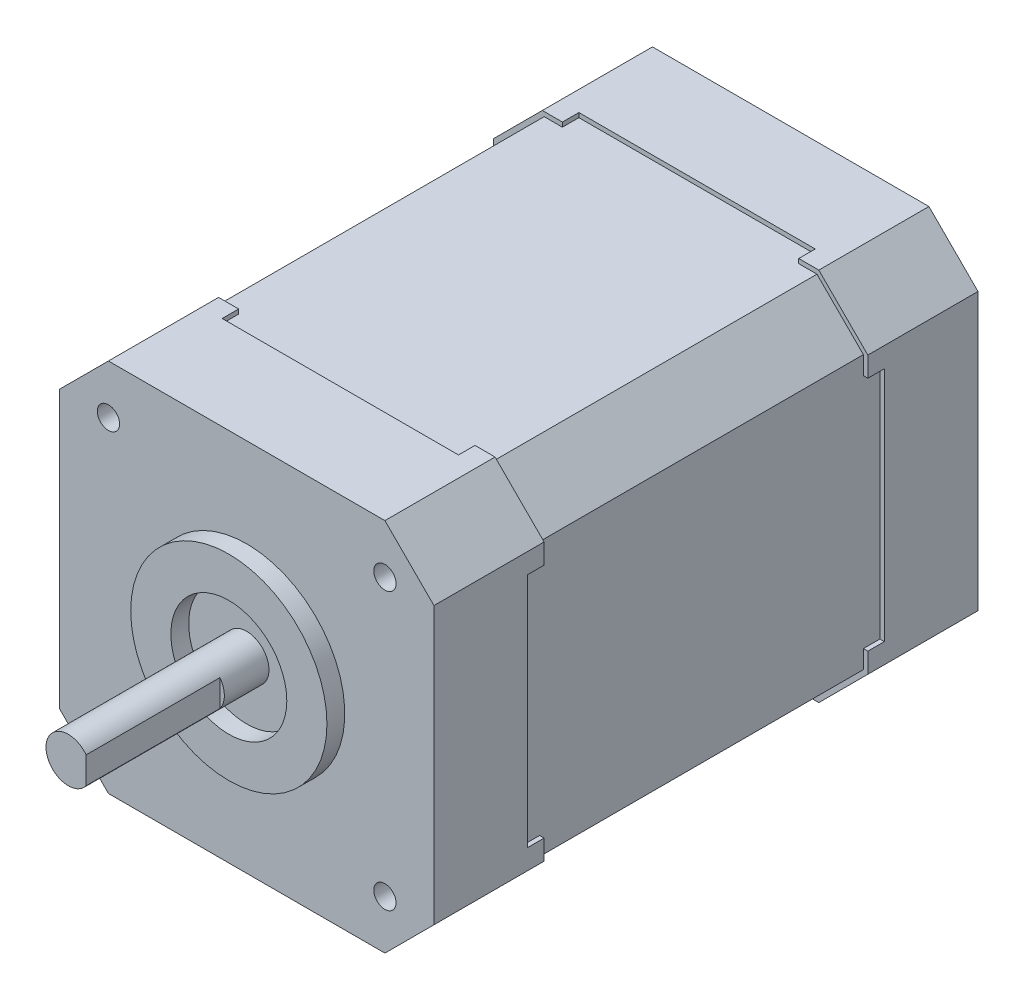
SolidWorks part; units mm, degrees
ref_plane "前基準面" through (0, 0, 0) normal (0, 0, 1) x (1, 0, 0)
ref_plane "上基準面" through (0, 0, 0) normal (0, 1, 0) x (1, 0, 0)
ref_plane "右基準面" through (0, 0, 0) normal (1, 0, 0) x (0, 0, -1)
sketch "草圖1" plane through (0, 0, 0) normal (0, 0, 1) x (1, 0, 0)
  line L0 (-21, 15.5) -> (-15.5, 21)
  line L1 (-15.5, 21) -> (15.5, 21)
  line L2 (-21, 15.5) -> (-21, -15.5)
  line L3 (-15.5, -21) -> (15.5, -21)
  line L4 (21, 15.5) -> (21, -15.5)
  line L5 (-18.25, 18.25) -> (18.25, -18.25) construction
  line L6 (-18.25, -18.25) -> (18.25, 18.25) construction
  line L7 (-21, -15.5) -> (-15.5, -21)
  line L8 (15.5, -21) -> (21, -15.5)
  line L9 (15.5, 21) -> (21, 15.5)
  point P0 (0, 0)
  dimension "D1" = 42
  dimension "D2" = 21
  dimension "D3" = 42
  dimension "D4" = 21
  dimension "D5" = 5.5
  dimension "D6" = 5.5
  dimension "D7" = 31
  dimension "D8" = 5.5
  dimension "D9" = 31
  dimension "D10" = 5.5
  dimension "D11" = 31
  dimension "D12" = 31
extrude "填料-伸長1" add sketch "草圖1" against normal blind 61
sketch "草圖2" plane through (0, 0, 0) normal (0, 0, 1) x (1, 0, 0)
  circle A0 centre (0, 0) radius 11
  circle A1 centre (0, 0) radius 6.5
  dimension "D1" = 22
  dimension "D2" = 13
extrude "填料-伸長2" add sketch "草圖2" along normal blind 2
sketch "草圖3" plane through (0, 0, 0) normal (0, 0, 1) x (1, 0, 0)
  circle A0 centre (0, 0) radius 2.5
  dimension "D1" = 5
extrude "填料-伸長3" add sketch "草圖3" along normal blind 20
sketch "草圖4" plane through (0, 0, 20) normal (0, 0, 1) x (1, 0, 0)
  line L0 (2, 1.5) -> (2, -1.5)
  arc A0 (2, -1.5) -> (2, 1.5) centre (0, 0) ccw
  dimension "D1" = 5
  dimension "D3" = 2
extrude "除料-伸長1" cut sketch "草圖4" against normal blind 15
ref_plane "平面1" through (0, 0, -12.35) normal (0, 0, 1) x (1, 0, 0)
sketch "草圖5" plane through (0, 0, -12.35) normal (0, 0, 1) x (1, 0, 0)
  line L0 (15.5, 21) -> (-15.5, 21) construction
  line L1 (21, 15.5) -> (15.5, 21) construction
  line L2 (21, -15.5) -> (21, 15.5) construction
  line L3 (15.5, -21) -> (21, -15.5) construction
  line L4 (-15.5, -21) -> (15.5, -21) construction
  line L5 (-21, -15.5) -> (-15.5, -21) construction
  line L6 (-21, 15.5) -> (-21, -15.5) construction
  line L7 (-15.5, 21) -> (-21, 15.5) construction
  line L8 (15.5, 21) -> (-15.5, 21)
  line L9 (21, 15.5) -> (15.5, 21)
  line L10 (21, -15.5) -> (21, 15.5)
  line L11 (15.5, -21) -> (21, -15.5)
  line L12 (-15.5, -21) -> (15.5, -21)
  line L13 (-21, -15.5) -> (-15.5, -21)
  line L14 (-21, 15.5) -> (-21, -15.5)
  line L15 (-15.5, 21) -> (-21, 15.5)
sketch "草圖6" plane through (0, 0, 0) normal (1, 0, 0) x (0, 0, -1)
  line L0 (12.35, 21) -> (12.35, 15.5) construction
  line L1 (12.35, 21) -> (48.65, 21)
  line L2 (12.35, 21) -> (12.35, 20.5)
  line L3 (12.35, 20.5) -> (48.65, 20.5)
  line L4 (48.65, 21) -> (48.65, 20.5)
  line L5 (61, 21) -> (0, 21) construction
  line L7 (61, 15.5) -> (61, 21) construction
  dimension "D1" = 0.5
  dimension "D2" = 12.35
sweep "除料-掃出1" cut profiles "草圖6" path "草圖5"
sketch "草圖7" plane through (0, 21, 0) normal (0, 1, 0) x (1, 0, 0)
  line L0 (15.5, 0) -> (-15.5, 0) construction
  line L1 (-13.25, 50.5) -> (13.25, 50.5)
  line L2 (-13.25, 50.5) -> (-13.25, 10.5)
  line L3 (-13.25, 10.5) -> (13.25, 10.5)
  line L4 (13.25, 50.5) -> (13.25, 10.5)
  line L6 (15.5, 61) -> (-15.5, 61) construction
  dimension "D1" = 10.5
  dimension "D2" = 26.5
  dimension "D3" = 13.25
  dimension "D4" = 10.5
extrude "除料-伸長2" cut sketch "草圖7" against normal up to surface (0.5 mm away)
sketch "草圖8" plane through (21, 0, 0) normal (1, 0, 0) x (0, 0, -1)
  line L0 (0, 11) -> (0, -11) construction
  line L1 (10.5, 13.25) -> (50.5, 13.25)
  line L2 (10.5, 13.25) -> (10.5, -13.25)
  line L3 (10.5, -13.25) -> (50.5, -13.25)
  line L4 (50.5, 13.25) -> (50.5, -13.25)
  line L5 (61, -15.5) -> (61, 15.5) construction
  dimension "D1" = 26.5
  dimension "D2" = 10.5
  dimension "D3" = 10.5
  dimension "D4" = 13.25
extrude "除料-伸長3" cut sketch "草圖8" against normal up to surface (0.5 mm away)
sketch "草圖9" plane through (0, -21, 0) normal (0, -1, 0) x (1, 0, 0)
  line L0 (-15.5, 0) -> (15.5, 0) construction
  line L1 (-13.25, -10.5) -> (13.25, -10.5)
  line L2 (-13.25, -10.5) -> (-13.25, -50.5)
  line L3 (-13.25, -50.5) -> (13.25, -50.5)
  line L4 (13.25, -10.5) -> (13.25, -50.5)
  line L5 (-15.5, -61) -> (15.5, -61) construction
  dimension "D1" = 13.25
  dimension "D2" = 26.5
  dimension "D3" = 10.5
  dimension "D4" = 10.5
extrude "除料-伸長4" cut sketch "草圖9" against normal up to surface (0.5 mm away)
sketch "草圖10" plane through (-21, 0, 0) normal (-1, 0, 0) x (0, 0, 1)
  line L0 (0, 15.5) -> (0, -15.5) construction
  line L1 (-50.5, 13.25) -> (-10.5, 13.25)
  line L2 (-50.5, 13.25) -> (-50.5, -13.25)
  line L3 (-50.5, -13.25) -> (-10.5, -13.25)
  line L4 (-10.5, 13.25) -> (-10.5, -13.25)
  line L5 (-61, 15.5) -> (-61, -15.5) construction
  dimension "D1" = 26.5
  dimension "D2" = 13.25
  dimension "D3" = 10.5
  dimension "D4" = 10.5
extrude "除料-伸長5" cut sketch "草圖10" against normal up to surface (0.5 mm away)
hole_wizard "M3 螺紋孔1" positions "草圖12" profile "草圖11" tap size "M3" standard "ISO"
sketch "草圖12" plane through (0, 0, 0) normal (0, 0, 1) x (1, 0, 0)
  point P1 (-15.5, 15.5)
  point P3 (15.5, 15.5)
  point P5 (15.5, -15.5)
  point P7 (-15.5, -15.5)
  dimension "D1" = 15.5
  dimension "D2" = 15.5
  dimension "D3" = 31
  dimension "D4" = 15.5
  dimension "D5" = 31
  dimension "D6" = 15.5
  dimension "D7" = 31
  dimension "D8" = 31
sketch "草圖11" plane through (-15.5, 15.5, 0) normal (1, 0, 0) x (0, -1, 0)
  line L0 (0, 0) -> (0, 5.2511)
  line L1 (0, 5.2511) -> (1.25, 4.5)
  line L2 (1.25, 4.5) -> (1.25, 0)
  line L5 (1.25, 0) -> (0, 0)
  line L10 (0, 5.2511) -> (-1.25, 4.5) construction
  line L11 (0, -6.35) -> (0, 107.95) construction
  dimension "螺孔鑽直徑" = 2.5
  dimension "螺孔鑽深度" = 4.5
  dimension "導頭角度" = 118
sketch "草圖13" plane through (0, 0, -61) normal (0, 0, -1) x (-1, 0, 0)
  circle A0 centre (0, 0) radius 2.5
  dimension "D1" = 5
extrude "填料-伸長4" add sketch "草圖13" along normal blind 15
chamfer "導角1" distance 0.5 angle 45 1 edges at (-2.5, 0, -76)
